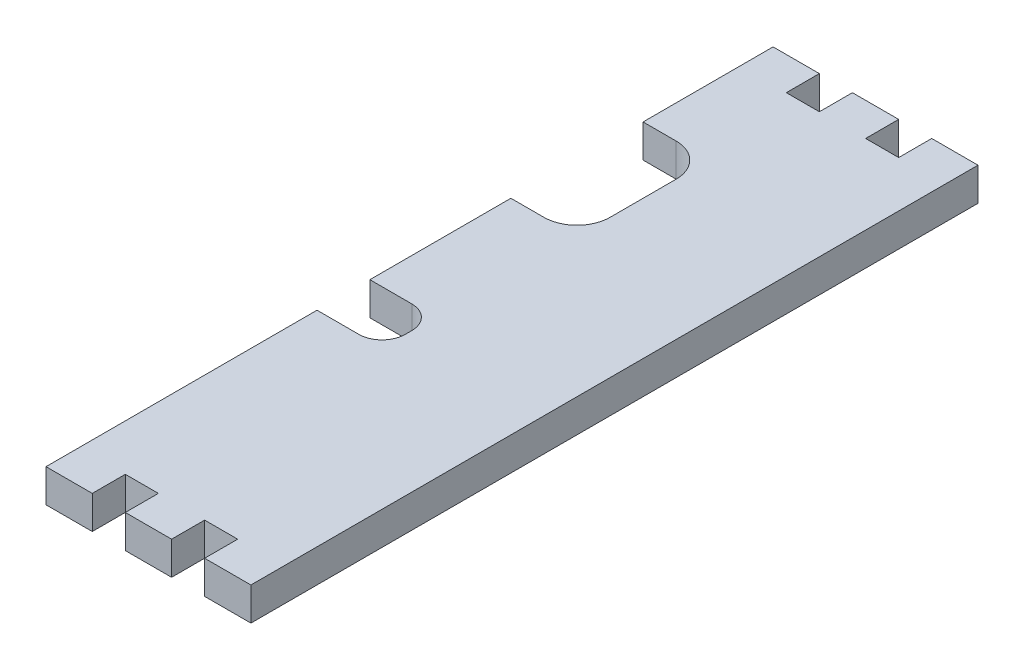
SolidWorks part; units mm, degrees
ref_plane "Plan de face" through (0, 0, 0) normal (0, 0, 1) x (1, 0, 0)
ref_plane "Plan de dessus" through (0, 0, 0) normal (0, 1, 0) x (1, 0, 0)
ref_plane "Plan de droite" through (0, 0, 0) normal (1, 0, 0) x (0, 0, -1)
sketch "Esquisse1" plane through (0, 0, 0) normal (0, 0, 1) x (1, 0, 0)
  line L1 (0, 0) -> (30, 0)
  line L2 (0, 0) -> (0, 5)
  line L3 (0, 5) -> (30, 5)
  line L4 (30, 0) -> (30, 5)
  dimension "D1" = 5
  dimension "D2" = 30
extrude "Boss.-Extru.1" add sketch "Esquisse1" along normal blind 100
sketch "Esquisse2" plane through (0, 0, 100) normal (0, 0, 1) x (1, 0, 0)
  line L0 (0, 0) -> (30, 0) construction
  line L1 (0, 5) -> (7, 5)
  line L2 (0, 5) -> (0, 0)
  line L3 (0, 0) -> (7, 0)
  line L4 (7, 5) -> (7, 0)
  line L5 (19, 5) -> (19, 0)
  line L6 (12, 0) -> (19, 0)
  line L7 (12, 5) -> (12, 0)
  line L8 (12, 5) -> (19, 5)
  line L9 (31, 5) -> (31, 0)
  line L10 (24, 0) -> (31, 0)
  line L11 (24, 5) -> (24, 0)
  line L12 (24, 5) -> (31, 5)
  dimension "D1" = 7
  dimension "D3" = 5
  dimension "D4" = 5
  dimension "D2" = 3
extrude "Boss.-Extru.2" add sketch "Esquisse2" along normal blind 5 and the other way blind 105
sketch "Esquisse3" plane through (0, 5, 0) normal (0, 1, 0) x (1, 0, 0)
  line L0 (0, -105) -> (0, 5) construction
  line L1 (9.8407, -56) -> (0, -56)
  line L2 (9.8407, -56) -> (9.8407, -64)
  line L3 (9.8407, -64) -> (0, -64)
  line L4 (0, -56) -> (0, -64)
  line L5 (9.8407, -56) -> (0, -64) construction
  line L6 (9.8407, -64) -> (0, -56) construction
  line L7 (12, -100) -> (7, -100) construction
  point P0 (4.9203, -60)
  dimension "D1" = 40
  dimension "D2" = 8
extrude "Enlèv. mat.-Extru.1" cut sketch "Esquisse3" against normal blind 5
fillet "Congé1" radius 3.5 2 edges at (9.8407, 2.5, 64) (9.8407, 2.5, 56)
sketch "Esquisse4" plane through (0, 0, 0) normal (0, -1, 0) x (1, 0, 0)
  line L1 (-2, 14.6686) -> (5, 14.6686)
  line L2 (-2, 14.6686) -> (-2, 34.6686)
  line L3 (-2, 34.6686) -> (5, 34.6686)
  line L4 (10, 19.6686) -> (10, 29.6686)
  line L5 (-2, 14.6686) -> (10, 34.6686) construction
  line L6 (-2, 34.6686) -> (10, 14.6686) construction
  arc A0 (5, 34.6686) -> (10, 29.6686) centre (5, 29.6686) cw
  arc A1 (5, 14.6686) -> (10, 19.6686) centre (5, 19.6686) ccw
  point P0 (4, 24.6686)
  dimension "D3" = 5
  dimension "D1" = 20
  dimension "D2" = 12
extrude "Enlèv. mat.-Extru.2" cut sketch "Esquisse4" against normal blind 10
